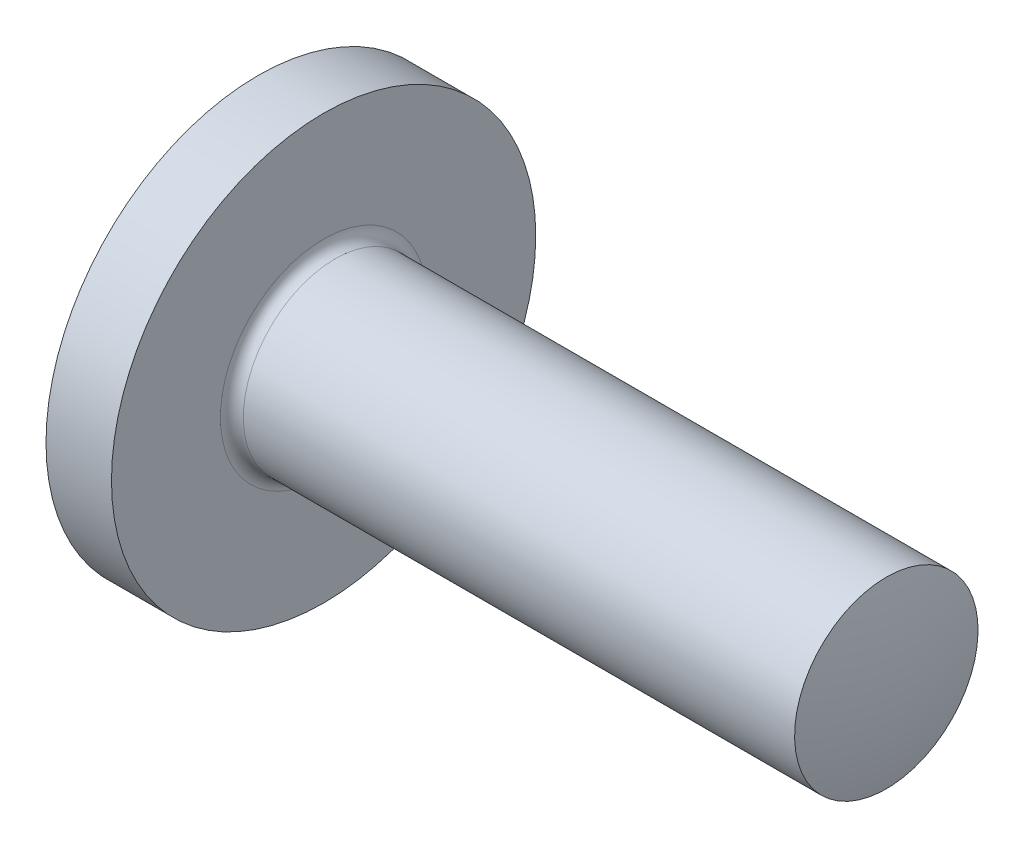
SolidWorks part; units mm, degrees
ref_plane "Front" through (0, 0, 0) normal (0, 0, 1) x (1, 0, 0)
ref_plane "Top" through (0, 0, 0) normal (0, 1, 0) x (1, 0, 0)
ref_plane "Right" through (0, 0, 0) normal (1, 0, 0) x (0, 0, -1)
sketch "Sketch1" plane through (0, 0, 0) normal (1, 0, 0) x (0, 0, -1)
  circle A0 centre (0, 0) radius 1.85
extrude "BaseHead" add sketch "Sketch1" along normal blind 1.1
sketch "Sketch2" plane through (1.1, 0.0676, 0.3015) normal (1, 0, 0) x (0, 0, -1)
  line L0 (0.3015, -0.0676) -> (1.3015, -0.0676) construction
  circle A0 centre (0.3015, -0.0676) radius 0.8
  circle A1 centre (0.3015, -0.0676) radius 1.85 construction
  dimension "d" = 1.6
  dimension "a" = 1
extrude "BaseBody" add sketch "Sketch2" along normal blind 5
sketch "Sketch3" plane through (0, 0, 0) normal (0, 0, 1) x (1, 0, 0)
  line L1 (0, 0.25) -> (0.5, 0.25)
  line L2 (0, 0.25) -> (0, -0.25)
  line L3 (0, -0.25) -> (0.5, -0.25)
  line L4 (0.5, 0.25) -> (0.5, -0.25)
  line L5 (0, 1.85) -> (0, -1.85) construction
  dimension "t" = 0.5
  dimension "m" = 0.25
  dimension "n" = 0.5
extrude "Slot" cut sketch "Sketch3" against normal through all and the other way through all
sketch "Sketch4" plane through (-5.7638, 3.9138, 0) normal (0, 0, 1) x (0, -1, 0)
  line L0 (3.9138, 15.0989) -> (3.9138, -3.5713) construction
  line L1 (3.1138, 11.8638) -> (3.1138, 6.8638) construction
  line L2 (2.0638, 6.8638) -> (2.0638, 5.7638) construction
  line L4 (3.1138, 13.8638) -> (3.1138, 11.7711)
  line L5 (3.9138, 11.8638) -> (3.9138, 13.8638)
  line L6 (3.9138, 13.8638) -> (3.1138, 13.8638)
  line L8 (2.0638, 3.7638) -> (3.9138, 3.7638)
  line L9 (3.9138, 3.7638) -> (3.9138, 5.7638)
  line L10 (2.0638, 6.2927) -> (2.0638, 3.7638)
  line L11 (2.0638, 5.7638) -> (3.6638, 5.7638) construction
  line L13 (4.7138, 11.8638) -> (3.1138, 11.8638) construction
  arc A0 (2.0638, 6.2927) -> (3.9138, 5.7638) centre (3.9138, 9.2638) ccw
  arc A1 (3.9138, 11.8638) -> (3.1138, 11.7711) centre (3.9138, 8.3638) ccw
  dimension "re" = 3.5
  dimension "D2" = 2
  dimension "D3" = 2
revolve "BaseTop" cut sketch "Sketch4" angle 360 about L0
fillet "HeadFillet" radius 0.1 1 edges at (1.1, 0, -0.8)
sketch "Sketch5" plane through (0, 0, 0) normal (0, 0, 1) x (1, 0, 0)
  line L0 (6.0073, 0.6268) -> (6.1073, 0.8)
  line L1 (6.1073, 0.8) -> (6.1073, 1)
  line L2 (6.1073, 1) -> (5.9073, 1)
  line L3 (5.9073, 1) -> (5.9073, 0.8)
  line L4 (5.9073, 0.8) -> (6.0073, 0.6268)
  line L5 (6.0073, 0.8) -> (6.0073, -0.8) construction
  line L6 (0, 0) -> (7.0548, 0) construction
  dimension "D1" = 1.6
  dimension "D2" = 0.2
revolve "Cut-Revolve10" [suppressed] cut sketch "Sketch5" angle 360 about L6
pattern_linear "LPattern10" [suppressed] count 17 spacing 0.24 along (1, 0, 0)
equation "\"m@Sketch3\" =\"n@Sketch3\" / 2"
equation "\"D1@ThreadCosmetic1\" = \"l@BaseBody\" -\"a@Sketch2\""
equation "\"D1@Sketch5\" = \"d@Sketch2\""
equation "\"D2@Sketch5\" =  ( \"d@Sketch2\" - \"D2@ThreadCosmetic1\" )  / 2"
equation "\"D3@LPattern10\" = \"D2@Sketch5\" * 1.2"
equation "\"D1@LPattern10\" = \"D1@ThreadCosmetic1\" / \"D3@LPattern10\""
